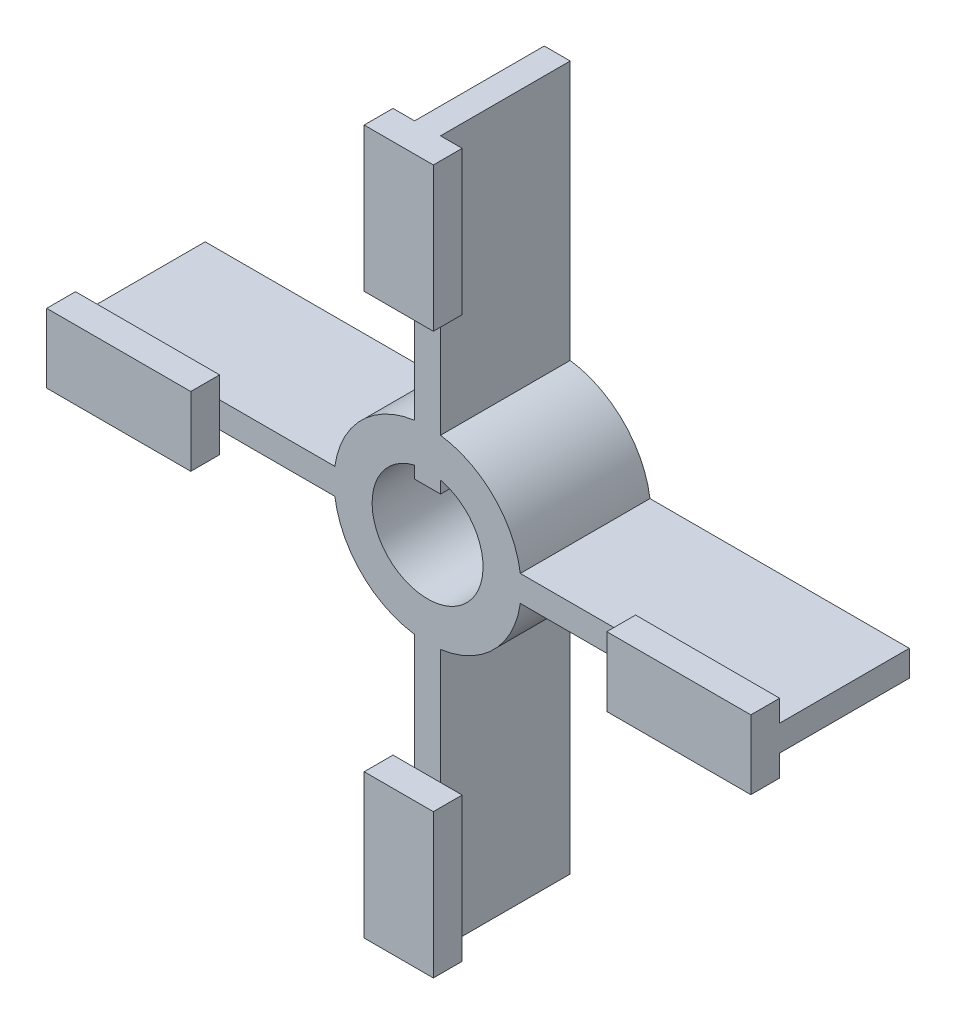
SolidWorks part; units mm, degrees
ref_plane "Front Plane" through (0, 0, 0) normal (0, 0, 1) x (1, 0, 0)
ref_plane "Top Plane" through (0, 0, 0) normal (0, 1, 0) x (1, 0, 0)
ref_plane "Right Plane" through (0, 0, 0) normal (1, 0, 0) x (0, 0, -1)
sketch "Sketch1" plane through (0, 0, 0) normal (0, 0, 1) x (1, 0, 0)
  line L12 (-1.143, 8.1755) -> (-1.143, 31.0355)
  line L13 (-1.143, 31.0355) -> (1.143, 31.0355)
  line L14 (1.143, 31.0355) -> (1.143, 8.1755)
  line L15 (31.0355, -1.143) -> (8.1755, -1.143)
  line L16 (8.1755, 1.143) -> (31.0355, 1.143)
  line L17 (31.0355, 1.143) -> (31.0355, -1.143)
  line L18 (-1.143, -31.0355) -> (-1.143, -8.1755)
  line L19 (1.143, -8.1755) -> (1.143, -31.0355)
  line L20 (1.143, -31.0355) -> (-1.143, -31.0355)
  line L21 (-31.0355, 1.143) -> (-8.1755, 1.143)
  line L22 (-8.1755, -1.143) -> (-31.0355, -1.143)
  line L23 (-31.0355, -1.143) -> (-31.0355, 1.143)
  line L24 (0, 0) -> (1.143, 8.1755) construction
  circle A0 centre (0, 0) radius 4.826
  circle A1 centre (0, 0) radius 8.255
  dimension "D1" = 9.652
  dimension "D3" = 16.51
  dimension "D2" = 2.286
  dimension "D4" = 22.86
  dimension "D5" = 4
extrude "Boss-Extrude1" add sketch "Sketch1" along normal mid plane 11.43
sketch "Sketch2" plane through (0, 0, 5.715) normal (0, 0, 1) x (1, 0, 0)
  line L0 (1.143, 31.0355) -> (3.048, 31.0355)
  line L1 (3.048, 31.0355) -> (3.048, 18.3355)
  line L2 (3.048, 18.3355) -> (1.143, 18.3355)
  line L3 (1.143, 31.0355) -> (1.143, 8.1755) construction
  line L4 (0, -55) -> (0, 55) construction
  line L5 (-3.048, 18.3355) -> (-1.143, 18.3355)
  line L6 (-3.048, 31.0355) -> (-3.048, 18.3355)
  line L7 (-1.143, 31.0355) -> (-3.048, 31.0355)
  line L8 (-1.143, 31.0355) -> (1.143, 31.0355)
  line L9 (-1.143, 18.3355) -> (1.143, 18.3355)
  dimension "D1" = 12.7
  dimension "D2" = 1.905
extrude "Boss-Extrude2" add sketch "Sketch2" along normal blind 2.54
pattern_circular "CirPattern1" count 4 over 360 about axis through (0, 0, 0) along (0, 0, 1) of "Boss-Extrude2"
mirror "Mirror1" [suppressed] about plane through (0, 0, 0) normal (0, 0, 1)
sketch "Sketch4" plane through (0, 0, -5.715) normal (0, 0, -1) x (-1, 0, 0)
  circle A0 centre (0, 0) radius 2.286
  circle A1 centre (0, 0) radius 4.826 construction
  circle A2 centre (0, 0) radius 4.826
  dimension "D1" = 2.54
extrude "Boss-Extrude3" add sketch "Sketch4" against normal up to surface (11.43 mm away)
sketch "Sketch5" plane through (0, 0, 5.715) normal (0, 0, 1) x (1, 0, 0)
  line L0 (-1.143, 4.754) -> (-1.143, 3.6872)
  line L1 (-1.143, 3.6872) -> (1.143, 3.6872)
  line L2 (1.143, 3.6872) -> (1.143, 4.754)
  arc A1 (-1.143, 4.754) -> (1.143, 4.754) centre (0, 0) ccw
  point P6 (-1.2535, 5.3176)
  point P9 (1.143, 4.2206)
  point P10 (0, 0)
  point P11 (0, 3.6872)
  point P12 (1.143, 5.2538)
  dimension "D1" = 9.779
  dimension "D2" = 2.286
  dimension "D3" = 1.0668
extrude "Cut-Extrude1" cut sketch "Sketch5" against normal up to surface (11.43 mm away) contours A1 L2 L1 L0
equation "\"Slit Widths\"= .1"
equation "\"Slot Distance\"= 1.125"
equation "\"Slot Width\"= 0.25"
equation "\"Slot Radius\"=0.08"
equation "\"Inner Hole Diameter\"= .5"
equation "\"Outer Diameter\"= 2.5"
